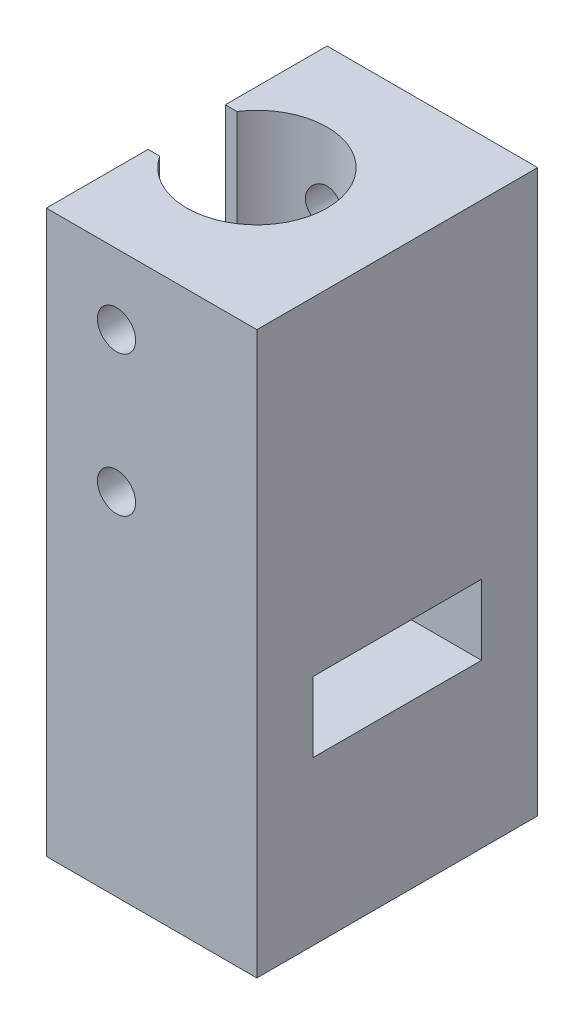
SolidWorks part; units mm, degrees
ref_plane "Front Plane" through (0, 0, 0) normal (0, 0, 1) x (1, 0, 0)
ref_plane "Top Plane" through (0, 0, 0) normal (0, 1, 0) x (1, 0, 0)
ref_plane "Right Plane" through (0, 0, 0) normal (1, 0, 0) x (0, 0, -1)
sketch "Sketch1" plane through (0, 0, 0) normal (0, 1, 0) x (1, 0, 0)
  line L1 (-39.3054, 22.1846) -> (-13.9054, 22.1846)
  line L2 (-39.3054, 22.1846) -> (-39.3054, -3.2154)
  line L3 (-39.3054, -3.2154) -> (-13.9054, -3.2154)
  line L4 (-13.9054, 22.1846) -> (-13.9054, -3.2154)
extrude "Boss-Extrude1" add sketch "Sketch1" along normal blind 50.8
sketch "Sketch2" plane through (0, 50.8, 0) normal (0, 1, 0) x (1, 0, 0)
  line L0 (-39.3054, 22.1846) -> (-39.3054, -3.2154) construction
  line L1 (-13.9054, 22.1846) -> (-39.3054, 22.1846) construction
  circle A0 centre (-26.6054, 9.4846) radius 4.445
  dimension "D1" = 12.7
  dimension "D2" = 12.7
extrude "Cut-Extrude1" cut sketch "Sketch2" against normal blind 44.45 contours A0
sketch "Sketch3" plane through (0, 50.8, 0) normal (0, 1, 0) x (1, 0, 0)
  line L0 (-13.9054, 22.1846) -> (-39.3054, 22.1846) construction
  line L1 (-39.3054, 22.1846) -> (-39.3054, -3.2154) construction
  circle A0 centre (-26.6054, 9.4846) radius 6.35
  dimension "D1" = 12.7
  dimension "D2" = 12.7
extrude "Cut-Extrude2" cut sketch "Sketch3" against normal blind 25.4
sketch "Sketch5" plane through (-39.3054, 0, 0) normal (-1, 0, 0) x (0, 0, 1)
  line L0 (-22.1846, 50.8) -> (3.2154, 50.8) construction
  line L1 (-12.9771, 50.8) -> (-5.9921, 50.8)
  line L2 (-12.9771, 50.8) -> (-12.9771, 15.494)
  line L3 (-12.9771, 15.494) -> (-5.9921, 15.494)
  line L4 (-5.9921, 50.8) -> (-5.9921, 15.494)
  line L5 (-22.1846, 50.8) -> (-22.1846, 0) construction
  dimension "D1" = 6.985
  dimension "D2" = 9.2075
extrude "Cut-Extrude3" cut sketch "Sketch5" against normal blind 12.7
sketch "Sketch6" plane through (-39.3054, 0, 0) normal (-1, 0, 0) x (0, 0, 1)
  line L0 (-22.1846, 50.8) -> (-22.1846, 0) construction
  line L1 (-17.1046, 21.082) -> (-1.8646, 21.082)
  line L2 (-17.1046, 21.082) -> (-17.1046, 14.732)
  line L3 (-17.1046, 14.732) -> (-1.8646, 14.732)
  line L4 (-1.8646, 21.082) -> (-1.8646, 14.732)
  line L5 (-22.1846, 0) -> (3.2154, 0) construction
  dimension "D1" = 5.08
  dimension "D2" = 14.732
  dimension "D3" = 6.35
  dimension "D4" = 15.24
extrude "Cut-Extrude4" cut sketch "Sketch6" against normal blind 25.4
hole_wizard "#8-32 Tapped Hole2" positions "Sketch9" profile "Sketch10" tap size "#8-32" standard "ANSI Inch"
sketch "Sketch9" plane through (0, 0, -22.1846) normal (0, 0, -1) x (-1, 0, 0)
  line L0 (13.9054, 50.8) -> (39.3054, 50.8) construction
  line L1 (13.9054, 50.8) -> (13.9054, 0) construction
  point P0 (26.6054, 44.45)
  point P2 (26.6054, 31.75)
  dimension "D1" = 6.35
  dimension "D2" = 12.7
  dimension "D3" = 12.7
  dimension "D4" = 12.7
sketch "Sketch10" plane through (-26.6054, 44.45, -22.1846) normal (1, 0, 0) x (0, 1, 0)
  line L0 (0, 0) -> (0, 6.35)
  line L1 (0, 6.35) -> (1.7272, 6.35)
  line L2 (1.7272, 6.35) -> (1.7272, 0)
  line L5 (1.7272, 0) -> (0, 0)
  line L11 (0, -6.35) -> (0, 107.95) construction
  dimension "Thru Tap Drill Dia." = 3.4544
  dimension "Thru Tap Drill Depth" = 6.35
hole_wizard "#8-32 Tapped Hole3" positions "Sketch11" profile "Sketch12" tap size "#8-32" standard "ANSI Inch"
sketch "Sketch11" plane through (0, 0, 3.2154) normal (0, 0, 1) x (1, 0, 0)
  line L0 (-39.3054, 50.8) -> (-13.9054, 50.8) construction
  line L1 (-39.3054, 50.8) -> (-39.3054, 0) construction
  point P0 (-26.6054, 44.45)
  point P2 (-26.6054, 31.75)
  dimension "D1" = 12.7
  dimension "D2" = 6.35
  dimension "D3" = 12.7
sketch "Sketch12" plane through (-26.6054, 44.45, 3.2154) normal (1, 0, 0) x (0, -1, 0)
  line L0 (0, 0) -> (0, 6.35)
  line L1 (0, 6.35) -> (1.7272, 6.35)
  line L2 (1.7272, 6.35) -> (1.7272, 0)
  line L5 (1.7272, 0) -> (0, 0)
  line L11 (0, -6.35) -> (0, 107.95) construction
  dimension "Thru Tap Drill Dia." = 3.4544
  dimension "Thru Tap Drill Depth" = 6.35
sketch "Sketch13" plane through (-39.3054, 0, 0) normal (-1, 0, 0) x (0, 0, 1)
  line L0 (-22.1846, 0) -> (3.2154, 0) construction
  line L1 (-13.9296, 7.9502) -> (-5.0396, 7.9502)
  line L2 (-13.9296, 7.9502) -> (-13.9296, 6.35)
  line L3 (-13.9296, 6.35) -> (-5.0396, 6.35)
  line L4 (-5.0396, 7.9502) -> (-5.0396, 6.35)
  line L5 (-22.1846, 50.8) -> (-22.1846, 0) construction
  dimension "D1" = 6.35
  dimension "D2" = 8.89
  dimension "D3" = 1.6002
  dimension "D4" = 8.255
extrude "Cut-Extrude5" cut sketch "Sketch13" against normal blind 12.7
sketch "Sketch17" plane through (0, 0, 0) normal (0, -1, 0) x (1, 0, 0)
  line L0 (-39.3054, 3.2154) -> (-13.9054, 3.2154) construction
  line L1 (-39.3054, -22.1846) -> (-32.9554, -22.1846)
  line L2 (-39.3054, -22.1846) -> (-39.3054, 3.2154)
  line L3 (-39.3054, 3.2154) -> (-32.9554, 3.2154)
  line L4 (-32.9554, -22.1846) -> (-32.9554, 3.2154)
  line L5 (-13.9054, -22.1846) -> (-39.3054, -22.1846) construction
  line L6 (-13.9054, 3.2154) -> (-20.2554, 3.2154)
  line L7 (-13.9054, 3.2154) -> (-13.9054, -22.1846)
  line L8 (-13.9054, -22.1846) -> (-20.2554, -22.1846)
  line L9 (-20.2554, 3.2154) -> (-20.2554, -22.1846)
extrude "Cut-Extrude18" cut sketch "Sketch17" against normal blind 50.8 contours L2 L1 L4 L3
